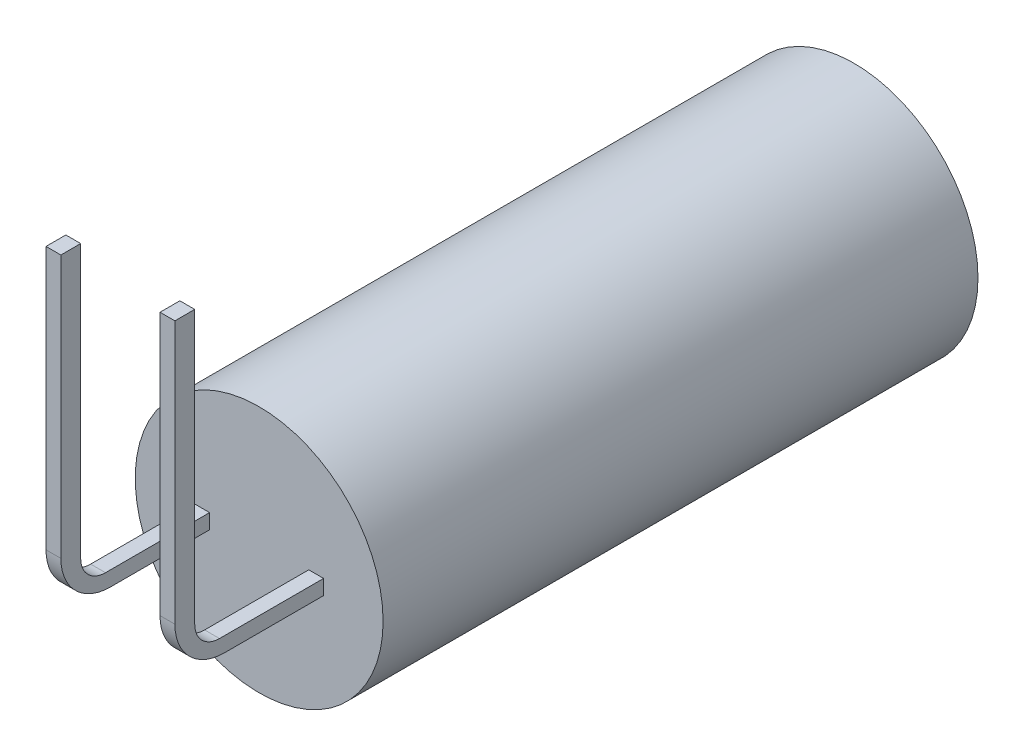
SolidWorks part; units mm, degrees
ref_plane "Plan de face" through (0, 0, 0) normal (0, 0, 1) x (1, 0, 0)
ref_plane "Plan de dessus" through (0, 0, 0) normal (0, 1, 0) x (1, 0, 0)
ref_plane "Plan de droite" through (0, 0, 0) normal (1, 0, 0) x (0, 0, -1)
sketch "Esquisse2" plane through (0, 0, 0) normal (0, 0, 1) x (1, 0, 0)
  circle A0 centre (0, 0) radius 2.5 construction
  circle A3 centre (0, 0) radius 2.5
extrude "Extrusion1" add sketch "Esquisse2" against normal blind 12
sketch "Esquisse5" plane through (0, 0, 0) normal (0, 0, 1) x (1, 0, 0)
  line L0 (0, 1.0031) -> (0, -1.0758) construction
  line L1 (-1.3, 0.15) -> (-1, 0.15)
  line L2 (-1.3, 0.15) -> (-1.3, -0.15)
  line L3 (-1.3, -0.15) -> (-1, -0.15)
  line L4 (-1, 0.15) -> (-1, -0.15)
  line L5 (1.3, 0.15) -> (1.3, -0.15)
  line L6 (1.3, 0.15) -> (1, 0.15)
  line L7 (1, 0.15) -> (1, -0.15)
  line L8 (1.3, -0.15) -> (1, -0.15)
  dimension "D1" = 1
  dimension "D2" = 0.15
  dimension "D3" = 0.15
  dimension "D4" = 1.3
extrude "Extrusion3" add sketch "Esquisse5" along normal blind 3
sketch "Esquisse6" plane through (0, 0.15, 0) normal (0, 1, 0) x (-1, 0, 0)
  line L0 (-1, 3) -> (-1, 0) construction
  line L1 (-1.3, 3) -> (-1, 3)
  line L2 (-1.3, 3) -> (-1.3, 2.6)
  line L3 (-1.3, 2.6) -> (-1, 2.6)
  line L4 (-1, 3) -> (-1, 2.6)
  line L5 (1.3, 3) -> (1.3, 0) construction
  line L6 (1, 3) -> (1.3, 3)
  line L7 (1, 3) -> (1, 2.6)
  line L8 (1, 2.6) -> (1.3, 2.6)
  line L9 (1.3, 3) -> (1.3, 2.6)
  dimension "D1" = 0.4
  dimension "D2" = 0.4
extrude "Extrusion4" add sketch "Esquisse6" along normal blind 6
fillet "Congé1" radius 1 2 edges at (-1.15, -0.15, 3) (1.15, -0.15, 3)
fillet "Congé2" radius 0.5 2 edges at (1.15, 0.15, 2.6) (-1.15, 0.15, 2.6)
